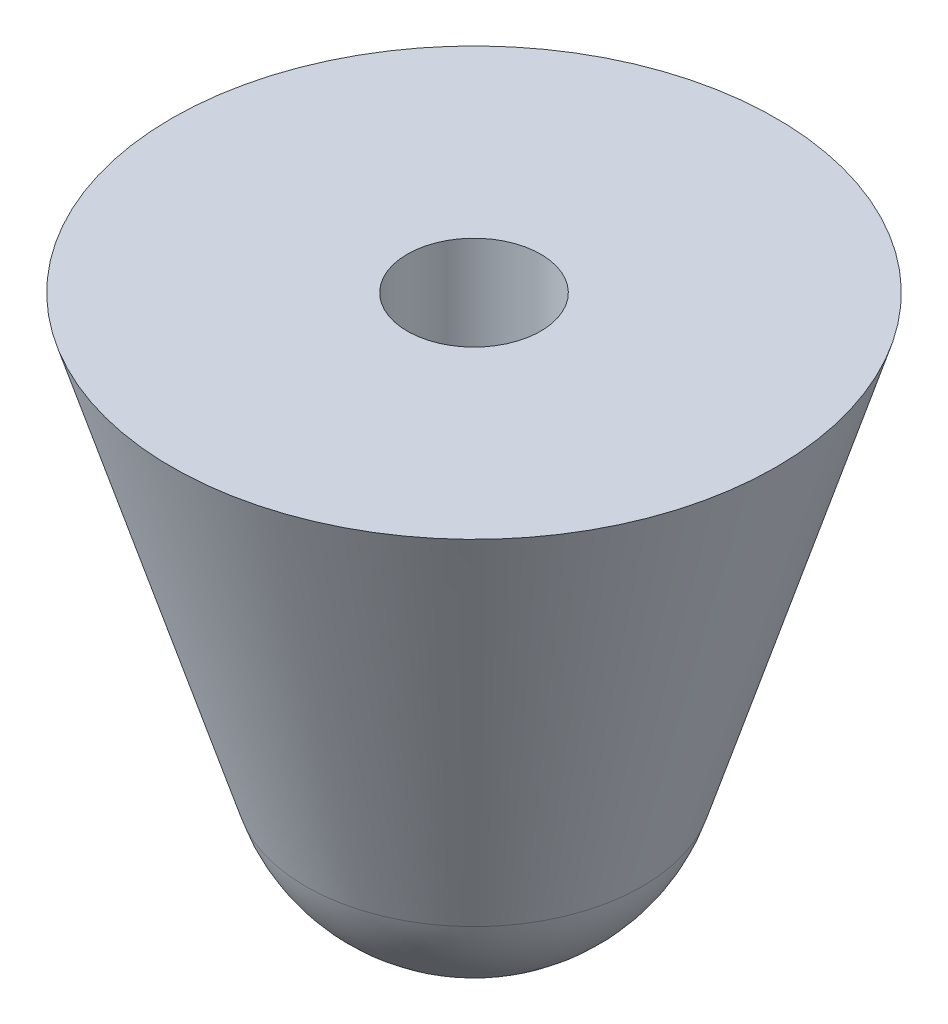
SolidWorks part; units mm, degrees
ref_plane "Front Plane" through (0, 0, 0) normal (0, 0, 1) x (1, 0, 0)
ref_plane "Top Plane" through (0, 0, 0) normal (0, 1, 0) x (1, 0, 0)
ref_plane "Right Plane" through (0, 0, 0) normal (1, 0, 0) x (0, 0, -1)
sketch "Sketch1" plane through (0, 0, 0) normal (0, 0, 1) x (1, 0, 0)
  line L0 (0, 0) -> (-6, 0)
  line L1 (-6, 0) -> (-3.3419, -8.5402)
  line L5 (0, 0) -> (0, -11)
  arc A0 (-3.3419, -8.5402) -> (0, -11) centre (0, -7.5) ccw
  point P4 (0, -11.5778)
  point P7 (-4.4566, -13.4943)
  point P8 (-1.1302, -11.3555)
  point P9 (-5.5845, -6.0103)
  point P10 (0, -6.8269)
  point P11 (-3.4071, -3.0834)
  point P12 (-3.1465, -5.408)
  point P13 (-2.2835, -6.4811)
  dimension "D1" = 6
  dimension "D3" = 3.5
  dimension "D2" = 11
revolve "Revolve1" add sketch "Sketch1" angle 360 about L5
sketch "Sketch2" plane through (0, 0, 0) normal (0, 1, 0) x (1, 0, 0)
  circle A0 centre (0, 0) radius 1.325
  dimension "D1" = 2.65
extrude "Cut-Extrude1" cut sketch "Sketch2" against normal blind 10
